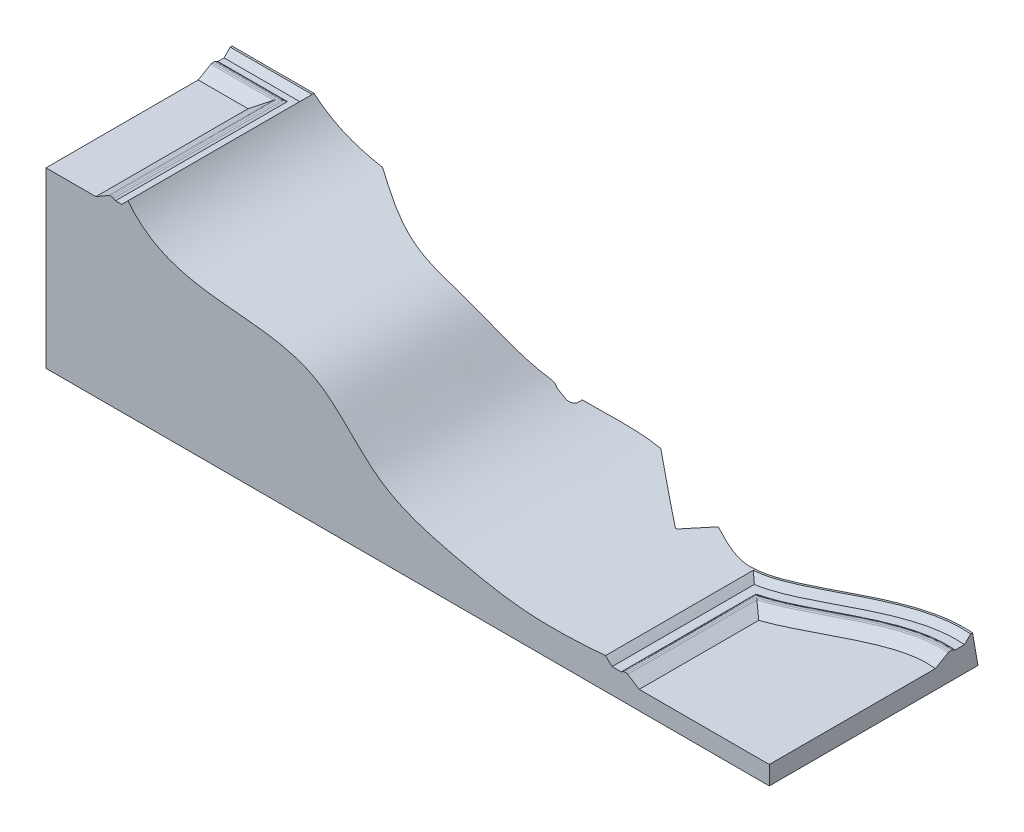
SolidWorks part; units mm, degrees
ref_plane "Ebene vorne" through (0, 0, 0) normal (0, 0, 1) x (1, 0, 0)
ref_plane "Ebene oben" through (0, 0, 0) normal (0, 1, 0) x (1, 0, 0)
ref_plane "Ebene rechts" through (0, 0, 0) normal (1, 0, 0) x (0, 0, -1)
imported_body "Importiert3"
sketch "Skizze1" plane through (0, 0, 0) normal (0, 0, 1) x (1, 0, 0)
  line L0 (-94.4033, 74.7453) -> (-94.4033, 58.5)
  line L1 (-94.4033, 58.5) -> (-82.8362, 58.5)
  line L2 (-82.8362, 58.5) -> (-82.8362, 60)
  spline S0 degree 3 poles (-82.8362, 60) (-83.2246, 60.4951) (-83.613, 60.9902) (-84.0013, 61.4853) (-87.4686, 65.9053) (-90.936, 70.3253) (-94.4033, 74.7453) knots 1 1 1 1 1.01 1.01 1.01 1.099276 1.099276 1.099276 1.099276
extrude "Schnitt-Linear austragen1" cut sketch "Skizze1" against normal blind 57.4
sketch "Skizze2" plane through (-94.4033, 0, 0) normal (-1, 0, 0) x (0, 0, 1)
  line L0 (-57.4, 58.5) -> (0, 58.5)
  line L1 (0, 58.5) -> (0, 0)
  line L2 (0, 0) -> (-70.5796, 0)
  line L3 (-70.5796, 0) -> (-57.4, 74.7453)
  line L4 (-57.4, 74.7453) -> (-57.4, 58.5)
extrude "Aufsatz-Linear austragen1" add sketch "Skizze2" along normal blind 14.8482
ref_plane "Ebene4" through (0, 58.5, 0) normal (0, 1, 0) x (-1, 0, 0)
ref_plane "Ebene5" through (0, 58, 0) normal (0, -1, 0) x (1, 0, 0)
sketch "Skizze4" plane through (0, 58, 0) normal (0, -1, 0) x (1, 0, 0)
  line L0 (-82.8362, -54.534) -> (-109.2515, -54.534)
  line L1 (-109.2515, -54.534) -> (-109.2515, -57.4)
  line L2 (-109.2515, -57.4) -> (-82.8362, -57.4)
  line L3 (-82.8362, -57.4) -> (-82.8362, -54.534)
extrude "Schnitt-Linear austragen2" cut sketch "Skizze4" against normal up to surface
sketch "Skizze5" plane through (-109.2515, 0, 0) normal (-1, 0, 0) x (0, 0, 1)
  line L0 (0, 58.5) -> (-53.3959, 58.5)
  line L1 (-53.3959, 58.5) -> (-53.3959, 56)
  line L2 (-53.3959, 56) -> (0, 56)
  line L3 (0, 56) -> (0, 58.5)
extrude "Schnitt-Linear austragen3" cut sketch "Skizze5" against normal blind 26.4153
draft "Formschräge1" type of draft neutral plane draft angle 45 faces to draft 1 parameters "D1"=45
draft "Formschräge2" type of draft neutral plane draft angle 60 faces to draft 2 parameters "D1"=60
chamfer "Fase1" distance 0.5179 angle 80 1 edges at (-96.2439, 60.5101, -59.9101)
fillet "Verrundung1" radius 0.5 1 edges at (46.5376, 4.7155, -47.1996)
fillet "Verrundung2" radius 1 2 edges at (-96.0438, 58.5, -53.3959) (-96.0438, 58.5, -54.534)
fillet "Verrundung4" radius 2 1 edges at (5, 9.5025, -55.3074)
sketch "Skizze15" plane through (0, 6, 0) normal (0, 1, 0) x (1, 0, 0)
  line L0 (71.135, 47.6501) -> (89.0113, 32.6501)
  line L1 (71.135, 36.3052) -> (71.135, 0) construction
  line L2 (71.135, 47.6501) -> (71.135, 32.6501)
  line L3 (71.135, 32.6501) -> (89.0113, 32.6501)
  dimension "D1" = 50
  dimension "D2" = 15
extrude "Schnitt-Linear austragen5" cut sketch "Skizze15" along normal through all
sketch "Skizze16" plane through (0, 0, 0) normal (0, 0, 1) x (1, 0, 0)
  line L0 (71.135, 10) -> (71.135, 6) construction
  line L1 (71.135, 10) -> (71.135, 6)
  line L2 (73.2663, 8) -> (76.2094, 8) construction
  line L3 (77.8339, 8.5) -> (77.2776, 8.5) construction
  line L4 (81.9992, 6) -> (71.135, 6) construction
  line L5 (73.2663, 8) -> (76.2094, 8)
  line L6 (77.8339, 8.5) -> (77.2776, 8.5)
  line L7 (81.9992, 6) -> (71.135, 6)
  spline S0 degree 3 poles (1071.1612, 1739.0933) (-784.8116, -1866.1981) (940.5913, 1874.1359) (-934.5372, -1716.7906) knots -51.848448 -51.848448 -51.848448 -51.848448 49.706035 49.706035 49.706035 49.706035 only from (73.2663, 8) to (71.135, 10) construction
  spline S1 degree 3 poles (-717.4884, 1839.1461) (-70.1435, -18.1331) (12.4596, -30.9032) (76.4772, 8.1631) (129.8894, 40.7574) (170.0489, 110.402) (879.392, -1820.1971) knots -0.276328 -0.276328 -0.276328 -0.276328 0.000412 0.000412 0.000412 0.231305 0.231305 0.231305 0.231305 only from (76.2094, 8) to (76.8089, 8.366) construction
  spline S2 degree 3 poles (2010.0149, -495.8868) (-1906.8168, 282.9127) (2080.0342, -30.9954) (-1910.3895, -191.9441) knots -50.410317 -50.410317 -50.410317 -50.410317 52.956477 52.956477 52.956477 52.956477 only from (76.8089, 8.366) to (77.2776, 8.5) construction
  spline S3 degree 3 poles (2075.1543, -40.9904) (-1919.1611, -172.2011) (2041.774, 411.4496) (-1822.0088, -608.9609) knots -51.324092 -51.324092 -51.324092 -51.324092 50.436777 50.436777 50.436777 50.436777 only from (77.8339, 8.5) to (78.2959, 8.366) construction
  spline S4 degree 3 poles (1033.7949, 1753.2092) (252.2012, -178.5608) (177.9579, -55.7886) (80.9612, 6.6711) (80.6149, 6.8941) (80.2684, 7.1163) (79.9215, 7.3377) (3.4062, 56.1547) (-89.2577, 62.11) (-799.9549, -1781.7165) knots -0.422048 -0.422048 -0.422048 -0.422048 0.001512 0.001512 0.001512 0.003024 0.003024 0.003024 0.336548 0.336548 0.336548 0.336548 only from (81.9992, 6) to (78.2959, 8.366) construction
  spline S5 degree 3 poles (73.2663, 8) (72.5664, 8.6857) (71.8583, 9.357) (71.135, 10) knots 0 0 0 0 1 1 1 1
  spline S6 degree 3 poles (76.2094, 8) (76.2987, 8.0543) (76.388, 8.1086) (76.4772, 8.1631) (76.5878, 8.2306) (76.6984, 8.2982) (76.8089, 8.366) knots 0.000026 0.000026 0.000026 0.000026 0.000412 0.000412 0.000412 0.00089 0.00089 0.00089 0.00089
  spline S7 degree 3 poles (76.8089, 8.366) (76.9551, 8.4557) (77.1161, 8.5) (77.2776, 8.5) knots 0 0 0 0 1 1 1 1
  spline S8 degree 3 poles (77.8339, 8.5) (77.9932, 8.5) (78.1522, 8.4561) (78.2959, 8.366) knots 0 0 0 0 1 1 1 1
  spline S9 degree 3 poles (81.9992, 6) (81.6535, 6.2244) (81.3075, 6.4482) (80.9612, 6.6711) (80.6149, 6.8941) (80.2684, 7.1163) (79.9215, 7.3377) (79.3805, 7.6828) (78.8387, 8.0258) (78.2959, 8.366) knots 0 0 0 0 0.001512 0.001512 0.001512 0.003024 0.003024 0.003024 0.005382 0.005382 0.005382 0.005382
extrude "Aufsatz-Linear austragen2" add sketch "Skizze16" against normal up to surface (43.3921 mm away)
sketch "Skizze17" plane through (0, 56, 0) normal (0, 1, 0) x (-1, 0, 0)
  line L0 (82.8362, -59.4) -> (93.1704, -49.0658)
  line L1 (82.8362, -49.0658) -> (109.2515, -49.0658) construction
  line L2 (93.1704, -49.0658) -> (82.8362, -49.0658)
  line L3 (82.8362, -49.0658) -> (82.8362, -59.4)
  dimension "D1" = 45
extrude "Schnitt-Linear austragen6" cut sketch "Skizze17" along normal through all
sketch "Skizze18" plane through (0, 0, 0) normal (0, 0, 1) x (1, 0, 0)
  line L0 (-89.0723, 58.366) -> (-93.1704, 56) construction
  line L1 (-89.0723, 58.366) -> (-93.1704, 56)
  line L2 (-87.9702, 58.5) -> (-88.5723, 58.5) construction
  line L3 (-86.8362, 58) -> (-87.4702, 58.366) construction
  line L4 (-84.8362, 58) -> (-86.8362, 58) construction
  line L5 (-82.8362, 60) -> (-84.8362, 58) construction
  line L6 (-82.8362, 60) -> (-82.8362, 56) construction
  line L7 (-82.8362, 56) -> (-93.1704, 56) construction
  line L8 (-87.9702, 58.5) -> (-88.5723, 58.5)
  line L9 (-86.8362, 58) -> (-87.4702, 58.366)
  line L10 (-84.8362, 58) -> (-86.8362, 58)
  line L11 (-82.8362, 60) -> (-84.8362, 58)
  line L12 (-82.8362, 60) -> (-82.8362, 56)
  line L13 (-82.8362, 56) -> (-93.1704, 56)
  arc A0 (-88.5723, 58.5) -> (-89.0723, 58.366) centre (-88.5723, 57.5) ccw construction
  arc A1 (-87.4702, 58.366) -> (-87.9702, 58.5) centre (-87.9702, 57.5) ccw construction
  arc A2 (-88.5723, 58.5) -> (-89.0723, 58.366) centre (-88.5723, 57.5) ccw
  arc A3 (-87.4702, 58.366) -> (-87.9702, 58.5) centre (-87.9702, 57.5) ccw
extrude "Aufsatz-Linear austragen3" add sketch "Skizze18" against normal up to surface (54.266 mm away)
